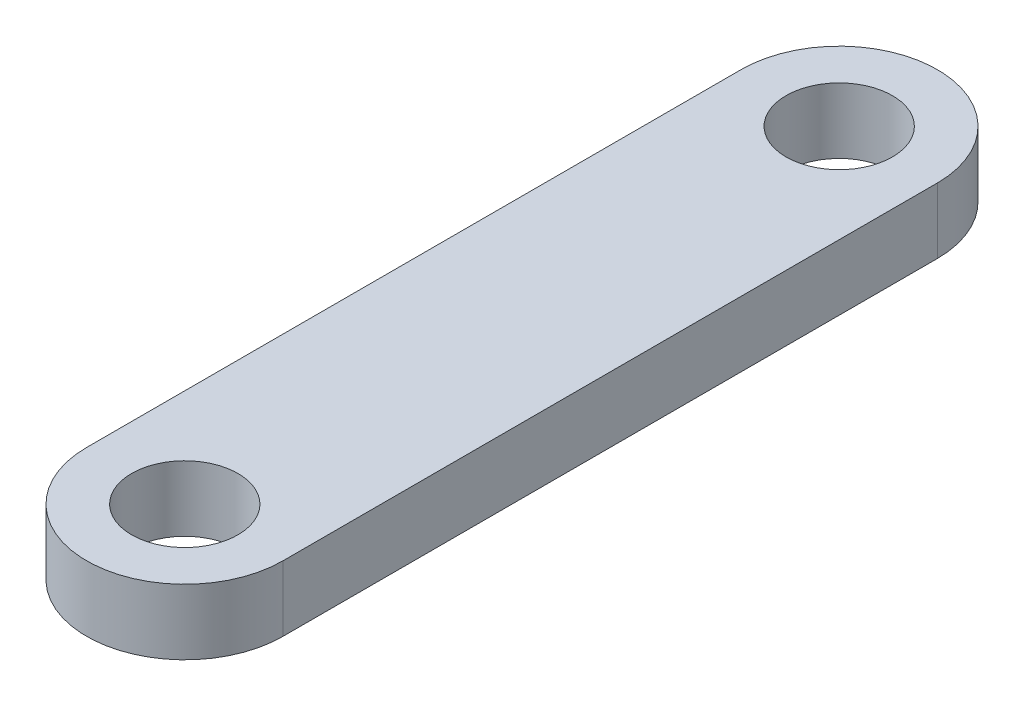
SolidWorks part; units mm, degrees
ref_plane "Front Plane" through (0, 0, 0) normal (0, 0, 1) x (1, 0, 0)
ref_plane "Top Plane" through (0, 0, 0) normal (0, 1, 0) x (1, 0, 0)
ref_plane "Right Plane" through (0, 0, 0) normal (1, 0, 0) x (0, 0, -1)
sketch "Sketch1" plane through (0, 0, 0) normal (0, 1, 0) x (1, 0, 0)
  line L0 (0, 0) -> (0, 40) construction
  line L1 (6, 40) -> (6, 0)
  line L2 (-6, 40) -> (-6, 0)
  arc A0 (6, 40) -> (-6, 40) centre (0, 40) ccw
  arc A1 (-6, 0) -> (6, 0) centre (0, 0) ccw
  circle A2 centre (0, 40) radius 3.25
  circle A3 centre (0, 0) radius 3.25
  dimension "D1" = 6.5
  dimension "D2" = 6
  dimension "D3" = 40
extrude "Extrude1" add sketch "Sketch1" along normal blind 4
